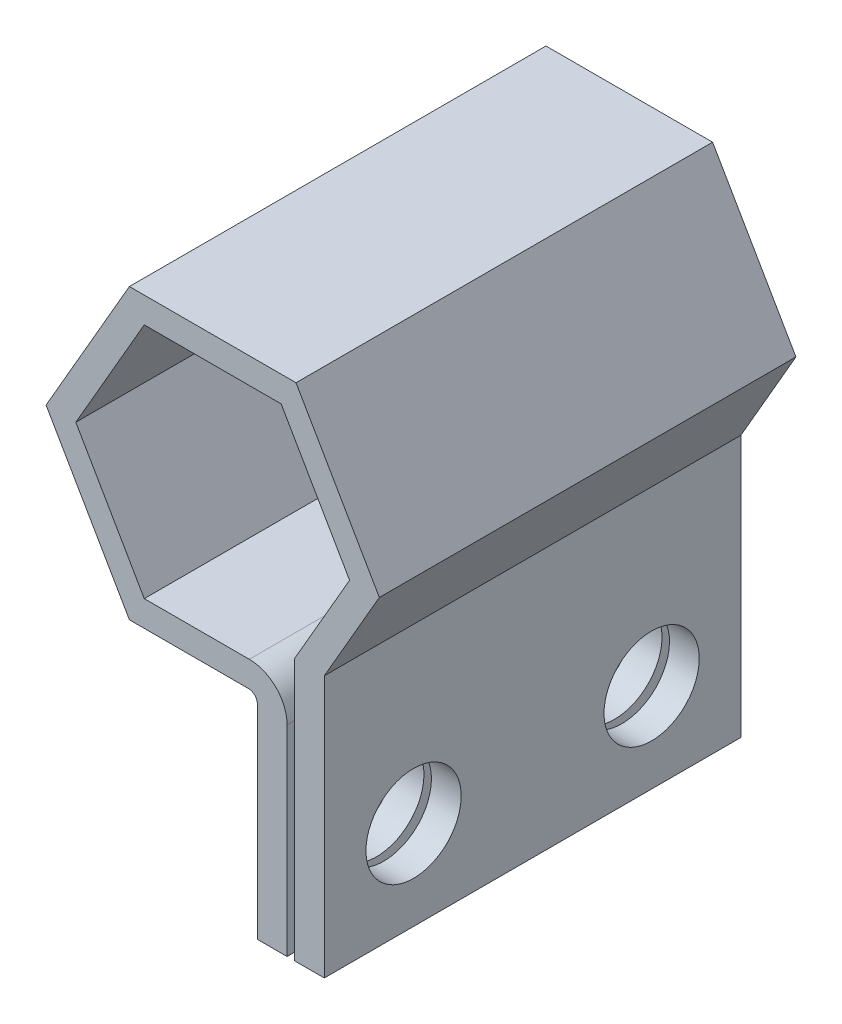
SolidWorks part; units mm, degrees
ref_plane "Front Plane" through (0, 0, 0) normal (0, 0, 1) x (1, 0, 0)
ref_plane "Top Plane" through (0, 0, 0) normal (0, 1, 0) x (1, 0, 0)
ref_plane "Right Plane" through (0, 0, 0) normal (1, 0, 0) x (0, 0, -1)
sketch "Sketch1" plane through (0, 0, 0) normal (0, 0, 1) x (1, 0, 0)
  line L0 (0, 0) -> (0, -7.6522) construction
  line L1 (5.6, 0) -> (2.8, 4.8497)
  line L2 (2.8, 4.8497) -> (-2.8, 4.8497)
  line L3 (-2.8, 4.8497) -> (-5.6, 0)
  line L4 (-5.6, 0) -> (-2.8, -4.8497)
  line L5 (-2.8, -4.8497) -> (1.2, -4.8497)
  line L6 (3.75, -3.2043) -> (5.6, 0)
  line L7 (4.6, 0) -> (2.3, 3.9837)
  line L8 (2.3, 3.9837) -> (-2.3, 3.9837)
  line L9 (-2.3, 3.9837) -> (-4.6, 0)
  line L10 (-4.6, 0) -> (-2.3, -3.9837)
  line L11 (-2.3, -3.9837) -> (1.23, -3.9837)
  line L12 (2.75, -3.2043) -> (4.6, 0)
  line L14 (3.75, -12) -> (2.75, -12)
  line L17 (1.5, -5.1497) -> (1.5, -12)
  line L19 (1.5, 0) -> (1.5, -7.6522) construction
  line L20 (2.5, -5.2537) -> (2.5, -12)
  line L21 (2.75, -3.2043) -> (2.75, -12)
  line L22 (1.5, -3.9837) -> (1.5, -12) construction
  line L24 (2.5, -12) -> (1.5, -12)
  line L25 (2.75, -4.8497) -> (2.8, -4.8497)
  line L26 (2.75, -3.2043) -> (2.75, -12) construction
  line L27 (2.5, -3.9837) -> (2.5, -12) construction
  line L29 (3.75, -3.2043) -> (3.75, -12)
  arc A2 (1.2, -4.8497) -> (1.5, -5.1497) centre (1.2, -5.1497) cw
  arc A3 (1.23, -3.9837) -> (2.5, -5.2537) centre (1.23, -5.2537) cw
  dimension "D8" = 0.3
  dimension "D9" = 1.27
  dimension "D1" = 11.2
  dimension "D2" = 9.2
  dimension "D10" = 8.7957
  dimension "D3" = 12
  dimension "D5" = 1.5
  dimension "D6" = 1
  dimension "D7" = 1
extrude "Boss-Extrude1" add sketch "Sketch1" along normal blind 14
sketch "Sketch2" plane through (3.75, 0, 0) normal (1, 0, 0) x (0, 0, -1)
  line L0 (-14, -3.2043) -> (-14, -12) construction
  line L1 (-14, -12) -> (0, -12) construction
  circle A0 centre (-11, -9) radius 1.6
  circle A1 centre (-3, -9) radius 1.6
  dimension "D1" = 3.2
  dimension "D2" = 3
  dimension "D3" = 3
  dimension "D4" = 8
extrude "Cut-Extrude1" cut sketch "Sketch2" against normal up to vertex
